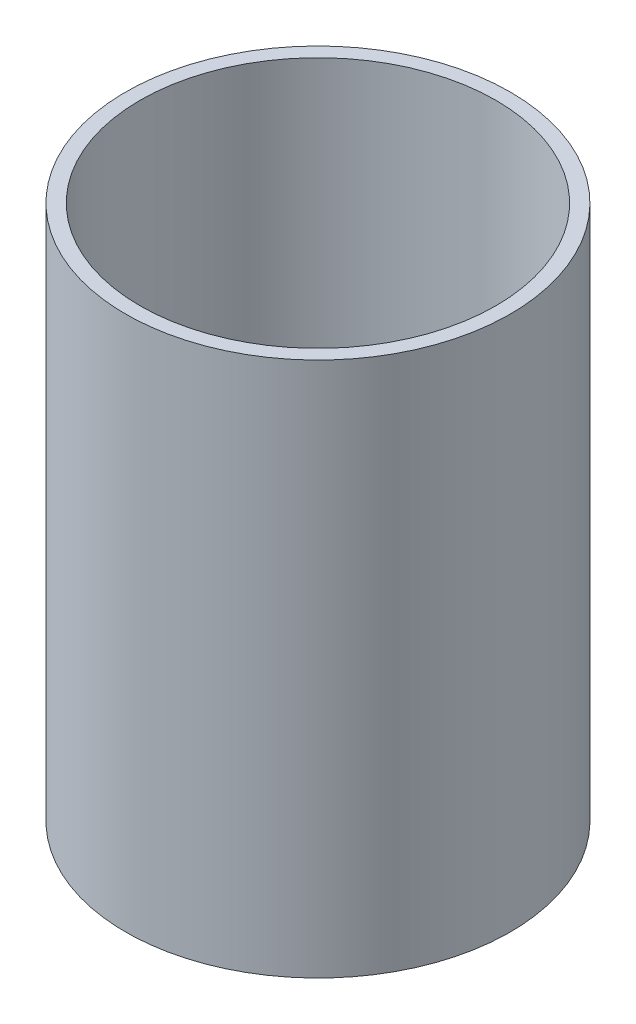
SolidWorks part; units mm, degrees
ref_plane "Front Plane" through (0, 0, 0) normal (0, 0, 1) x (1, 0, 0)
ref_plane "Top Plane" through (0, 0, 0) normal (0, 1, 0) x (1, 0, 0)
ref_plane "Right Plane" through (0, 0, 0) normal (1, 0, 0) x (0, 0, -1)
sketch "Sketch1" plane through (0, 0, 0) normal (0, 1, 0) x (1, 0, 0)
  circle A0 centre (0, 0) radius 101.3587
  circle A1 centre (0, 0) radius 109.5375
  dimension "D1" = 202.7174
  dimension "D2" = 219.075
extrude "Boss-Extrude1" add sketch "Sketch1" along normal blind 304.8
